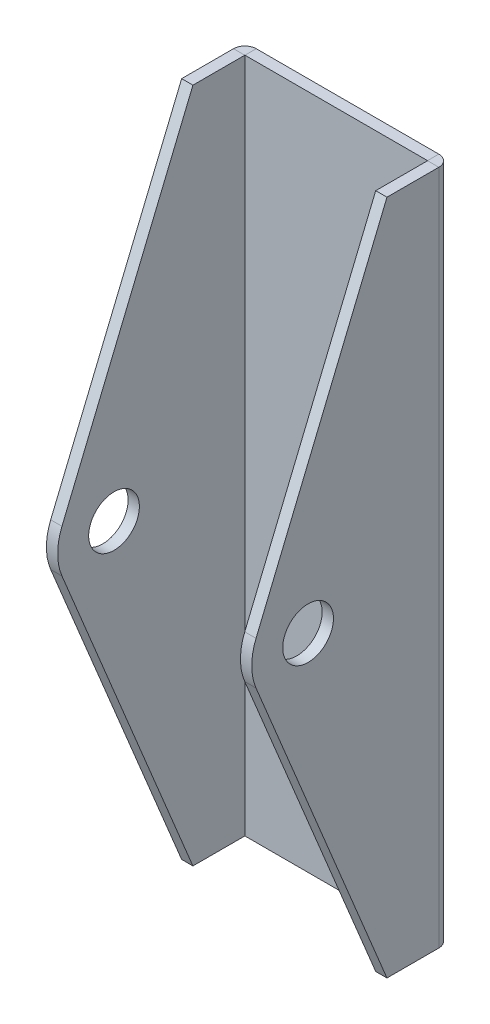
SolidWorks part; units mm, degrees
ref_plane "Front" through (0, 0, 0) normal (0, 0, 1) x (1, 0, 0)
ref_plane "Top" through (0, 0, 0) normal (0, 1, 0) x (1, 0, 0)
ref_plane "Right" through (0, 0, 0) normal (1, 0, 0) x (0, 0, -1)
sketch "Sketch1" plane through (0, 0, 0) normal (0, 0, 1) x (1, 0, 0)
  line L1 (-12.3999, -30.0002) -> (14.6012, -30.0002)
  line L2 (-12.3999, 30.0002) -> (14.6012, 30.0002)
  line L8 (-12.3999, 30.0002) -> (-24.0196, 1.9113)
  line L9 (-12.3999, -30.0002) -> (-24.0196, -1.9113)
  line L10 (14.6012, -30.0002) -> (26.221, -1.9113)
  line L11 (14.6012, 30.0002) -> (26.221, 1.9113)
  circle A0 centre (1.1007, 0) radius 2.75
  circle A1 centre (-19.3993, 0) radius 2.25
  arc A2 (-24.0196, 1.9113) -> (-24.0196, -1.9113) centre (-19.3993, 0) ccw
  circle A3 centre (21.6007, 0) radius 2.25
  arc A4 (26.221, 1.9113) -> (26.221, -1.9113) centre (21.6007, 0) cw
sheet metal parameters "Sheet-Metal1" thickness 1 parameters "D1"=0.01
base flange "Base-Flange1" sketch "Sketch1" thickness 1 reverse thickness direction yes parameters "D1"=0.01
sketch "Sketch3" plane through (0, 0, 1) normal (0, 0, 1) x (1, 0, 0)
  line L5 (-7.3993, 30.0002) -> (-7.3993, -30.0002)
  line L6 (9.6007, 30.0002) -> (9.6007, -30.0002)
sketched bend "Sketched Bend1" parameters "D1"=0
bend "SketchBend3" bend radius 0.01 bend angle 90 parameters "D5"=1
bend "SketchBend4" bend radius 0 bend angle 90 parameters "D5"=2
flat pattern "Flat-Pattern1"
sketch "Bend-Lines1" plane through (0, 0, 1) normal (0, 0, 1) x (1, 0, 0)
  line L0 (9.6007, -30.0002) -> (9.6007, 30.0002) construction
  line L1 (-7.3993, -30.0002) -> (-7.3993, 30.0002) construction
bend of the flat pattern "Flatten-<SketchBend3>1"
bend of the flat pattern "Flatten-<SketchBend4>1"
